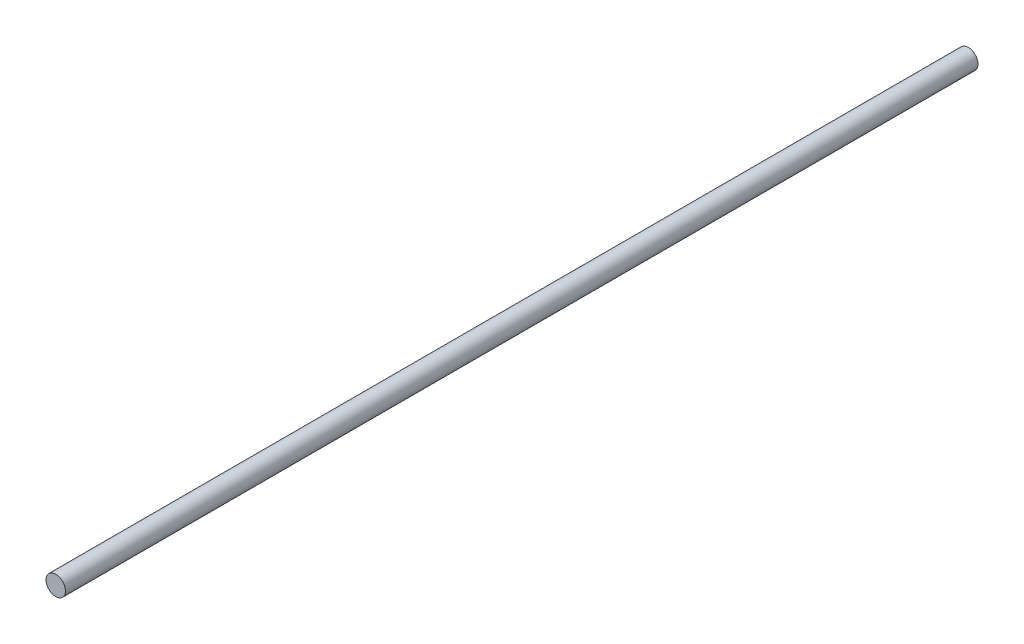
SolidWorks part; units mm, degrees
ref_plane "Front Plane" through (0, 0, 0) normal (0, 0, 1) x (1, 0, 0)
ref_plane "Top Plane" through (0, 0, 0) normal (0, 1, 0) x (1, 0, 0)
ref_plane "Right Plane" through (0, 0, 0) normal (1, 0, 0) x (0, 0, -1)
sketch "Sketch1" plane through (0, 0, 0) normal (0, 0, 1) x (1, 0, 0)
  circle A0 centre (-24.4816, 51.1436) radius 4
extrude "Boss-Extrude1" add sketch "Sketch1" along normal blind 300 and the other way blind 75
